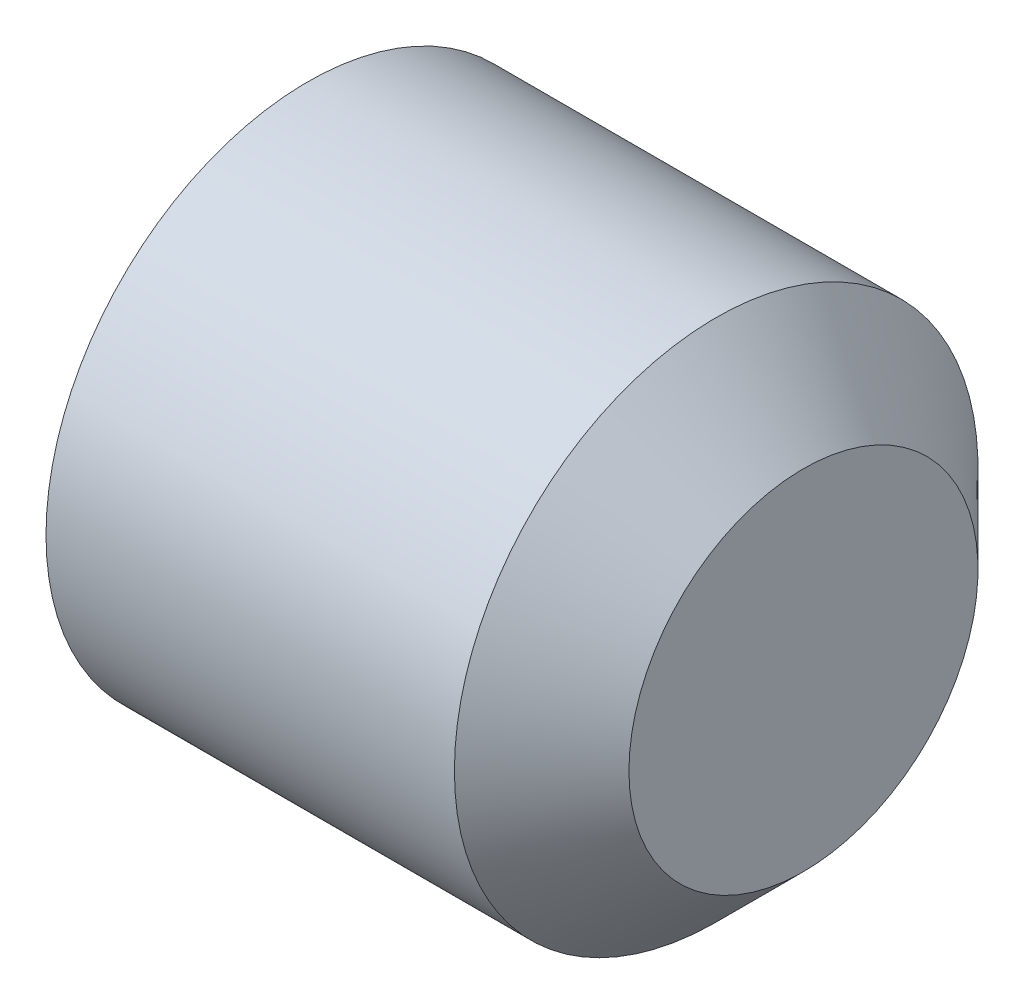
SolidWorks part; units mm, degrees
revolve "BaseBody" add sketch "BodySke" angle 360 about L5
sketch "BodySke" plane through (0, 0, 0) normal (0, 0, 1) x (1, 0, 0)
  line L0 (0, 0) -> (0, 2.4455)
  line L1 (0, 2.4455) -> (0.3201, 3)
  line L2 (0.3201, 3) -> (5, 3)
  line L3 (5, 3) -> (6, 2)
  line L4 (6, 0) -> (0, 0)
  line L5 (-12.7, 0) -> (88.9, 0) construction
  line L6 (6, 2) -> (6, 0)
  line L7 (6, 2) -> (6, 11.525) construction
  line L8 (0, -2.4455) -> (0.3201, -3) construction
  line L9 (1, 15.875) -> (1, -3.175) construction
  line L10 (5, -3) -> (6, -2) construction
ref_plane "Plane1" through (0, 0, 0) normal (0, 0, 1) x (1, 0, 0)
ref_plane "Plane2" through (0, 0, 0) normal (0, 1, 0) x (1, 0, 0)
ref_plane "Plane3" through (0, 0, 0) normal (1, 0, 0) x (0, 0, -1)
sketch "Sketch2" plane through (0, 0, 0) normal (-1, 0, 0) x (0, 0, 1)
  line L0 (0.866, 1.5) -> (-0.866, 1.5)
  line L1 (-0.866, 1.5) -> (-1.7321, 0)
  line L2 (0.866, 1.5) -> (1.7321, 0)
  line L3 (0.866, -1.5) -> (1.7321, 0)
  line L4 (0.866, -1.5) -> (-0.866, -1.5)
  line L5 (-0.866, -1.5) -> (-1.7321, 0)
extrude "Hex" cut sketch "Sketch2" against normal blind 2
sketch "ThdSchSke" plane through (0, 0, 0) normal (0, 0, 1) x (1, 0, 0)
  line L0 (0.3201, -2.4455) -> (-0.0681, -3)
  line L1 (0.3201, -2.4455) -> (0.7084, -3)
  line L2 (0.7084, -3) -> (0.7084, -3.75)
  line L3 (-3.175, 0) -> (5.1513, 0) construction
  line L5 (0.7084, -3.75) -> (-0.0681, -3.75)
  line L6 (-0.0681, -3.75) -> (-0.0681, -3)
  line L8 (0.3201, 3) -> (0.3201, -3) construction
revolve "ThreadSchematic" [suppressed] cut sketch "ThdSchSke" angle 360 about L3
pattern_linear "ThdSchPat" [suppressed]
equation "\"D2@Sketch2\" = \"Hex_size@Sketch2\" / 2"
equation "\"D3@Sketch2\" = \"Hex_size@Sketch2\" / 2"
equation "\"Thread_minor@ThreadCosmetic\" = \"Minor_dia@BodySke\""
equation "\"Thread_minor@ThdSchSke\" = \"Thread_minor@ThreadCosmetic\""
equation "\"Diameter@ThdSchSke\" = \"Diameter@BodySke\""
equation "\"Overcut@ThdSchSke\" = \"Diameter@BodySke\" * 1.25"
equation "\"Num_threads@ThdSchPat\" = int( (\"Length@BodySke\" - ( ( ( \"Diameter@BodySke\" - \"Minor_dia@BodySke\" ) * 0.5 ) / tan( \"Drive_ch_ang@BodySke\" * 0.017453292 ) ) - ( ( ( \"Diameter@BodySke\" - \"Cup_dia@BodySk"
equation "\"Advance@ThdSchPat\" = (\"Length@BodySke\" - ( ( ( \"Diameter@BodySke\" - \"Minor_dia@BodySke\" ) * 0.5 ) / tan( \"Drive_ch_ang@BodySke\" * 0.017453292 ) ) - ( ( ( \"Diameter@BodySke\" - \"Cup_dia@BodySke\" ) * 0."
equation "' \"Num_threads@ThdSchPat\" = \"Num_threads@ThdSchPat\" - sgn( \"Num_threads@ThdSchPat\" - 1) '---chamfered tips only---"
